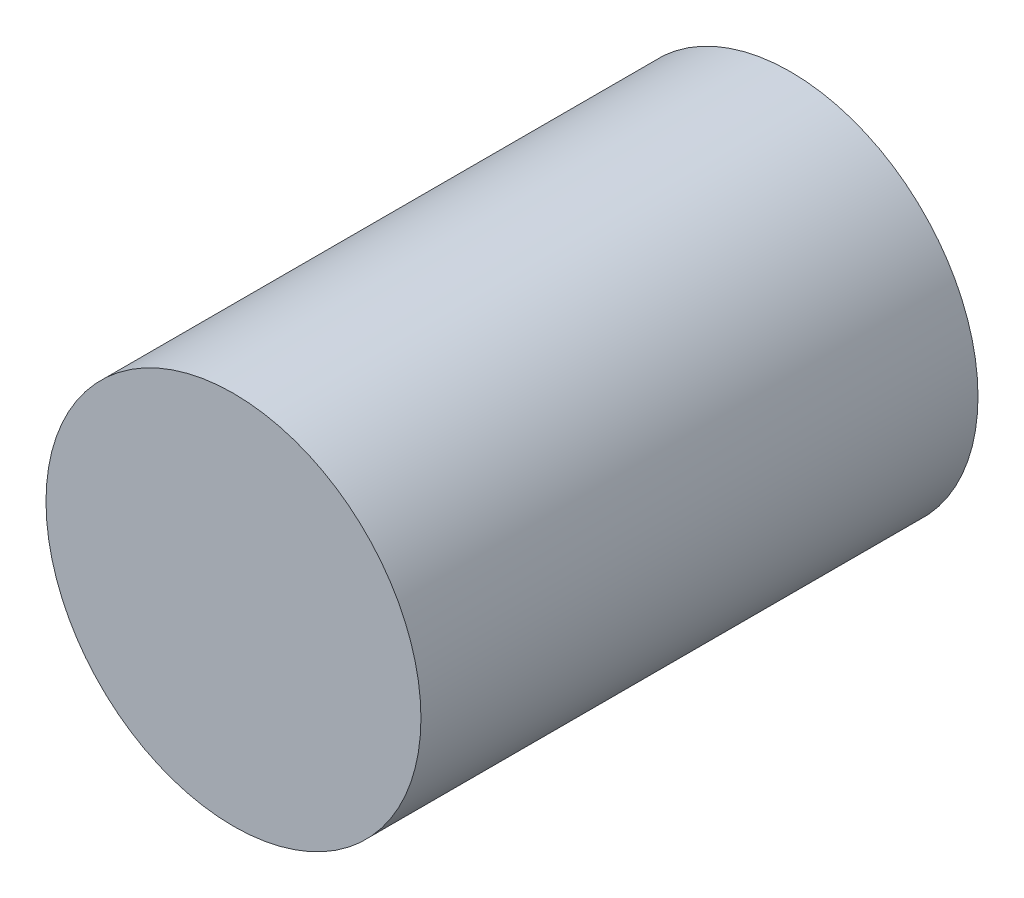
SolidWorks part; units mm, degrees
ref_plane "Спереди" through (0, 0, 0) normal (0, 0, 1) x (1, 0, 0)
ref_plane "Сверху" through (0, 0, 0) normal (0, 1, 0) x (1, 0, 0)
ref_plane "Справа" through (0, 0, 0) normal (1, 0, 0) x (0, 0, -1)
sketch "Эскиз1" plane through (0, 0, 0) normal (0, 0, 1) x (1, 0, 0)
  circle A0 centre (0, 0) radius 17.5
extrude "Бобышка-Вытянуть1" add sketch "Эскиз1" along normal blind 52
sketch "Эскиз2" plane through (0, 0, 0) normal (0, 0, -1) x (-1, 0, 0)
  circle A0 centre (0, 5) radius 1
  circle A1 centre (0, -5) radius 1
extrude "Бобышка-Вытянуть2" add sketch "Эскиз2" along normal blind 6
